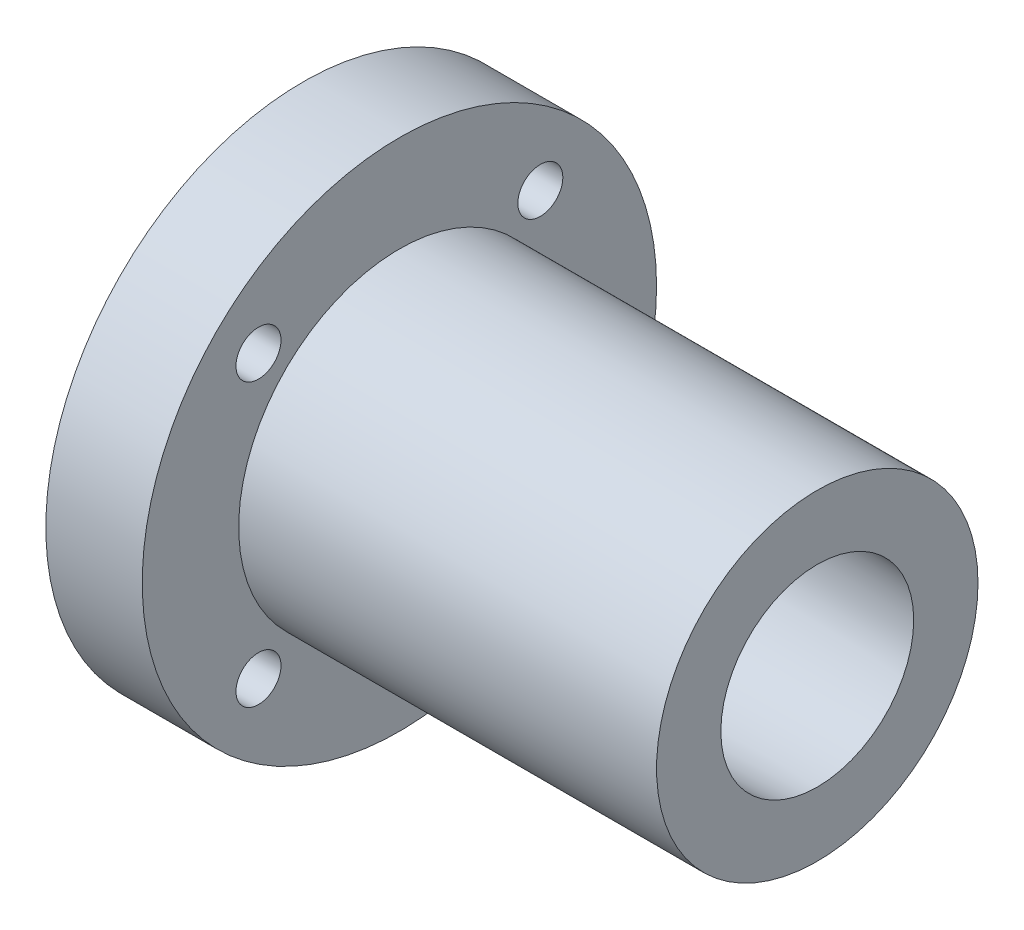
SolidWorks part; units mm, degrees
ref_plane "正面" through (0, 0, 0) normal (0, 0, 1) x (1, 0, 0)
ref_plane "平面" through (0, 0, 0) normal (0, 1, 0) x (1, 0, 0)
ref_plane "右側面" through (0, 0, 0) normal (1, 0, 0) x (0, 0, -1)
sketch "ｽｹｯﾁ1" plane through (0, 0, 0) normal (0, 0, 1) x (1, 0, 0)
  line L0 (0, 0) -> (80, 0)
  line L1 (80, 0) -> (80, 25)
  line L2 (80, 25) -> (15, 25)
  line L3 (15, 25) -> (15, 40)
  line L4 (15, 40) -> (0, 40)
  line L5 (0, 40) -> (0, 0)
  line L6 (0, 0) -> (-25.8964, 0) construction
  dimension "D1" = 15
  dimension "D2" = 80
  dimension "D3" = 80
  dimension "D4" = 50
revolve "回転2" add sketch "ｽｹｯﾁ1" angle 360 about L6
sketch "ｽｹｯﾁ2" plane through (0, 0, 0) normal (0, 0, 1) x (1, 0, 0)
  line L0 (0, 0) -> (80, 0)
  line L1 (80, 0) -> (80, 15)
  line L2 (80, 15) -> (0, 18)
  line L3 (0, 40) -> (0, -40) construction
  line L4 (0, 18) -> (0, 0)
  line L5 (80, -25) -> (80, 25) construction
  line L6 (0, 0) -> (-23.6455, 0) construction
  dimension "D1" = 36
  dimension "D2" = 30
revolve "ｶｯﾄ - 回転1" cut sketch "ｽｹｯﾁ2" angle 360 about L6
hole_wizard "Ø7.0 (7) 直径の穴1" positions "ｽｹｯﾁ3" profile "ｽｹｯﾁ5" hole size "Ø7.0" standard "JIS"
sketch "ｽｹｯﾁ3" plane through (0, 0, 0) normal (-1, 0, 0) x (0, 0, 1)
  line L0 (-21.9203, 21.9203) -> (0, 0)
  line L1 (0, 0) -> (-31, 0)
  circle A1 centre (0, 0) radius 31
  point P0 (-21.9203, 21.9203)
  dimension "D1" = 45
  dimension "D2" = 62
sketch "ｽｹｯﾁ5" plane through (0, 21.9203, -21.9203) normal (0, 1, 0) x (0, 0, 1)
  line L0 (0, 0) -> (0, 15.001)
  line L1 (0, 15.001) -> (3.5, 15.001)
  line L2 (3.5, 15.001) -> (3.5, 0)
  line L5 (3.5, 0) -> (0, 0)
  line L11 (0, -6.35) -> (0, 107.95) construction
  dimension "通し穴の直径" = 7
  dimension "通し穴の深さ" = 15.001
pattern_circular "円形ﾊﾟﾀｰﾝ1" count 4 over 360 about axis through (0, 0, 0) along (1, 0, 0) of "Ø7.0 (7) 直径の穴1"
